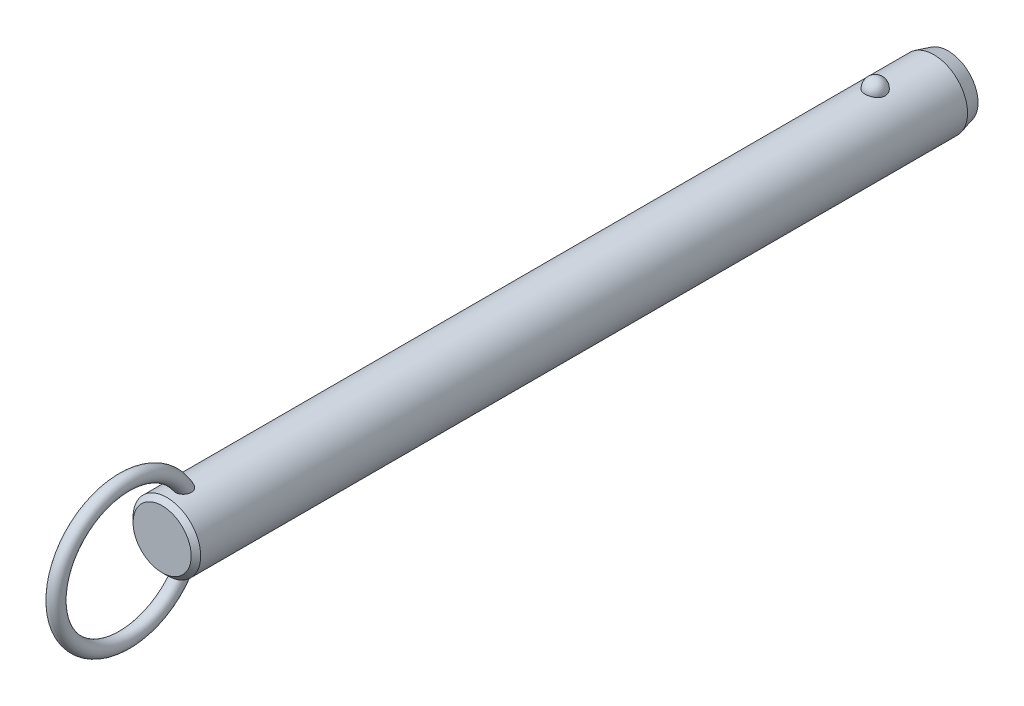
SolidWorks part; units mm, degrees
ref_plane "Front Plane" through (0, 0, 0) normal (0, 0, 1) x (1, 0, 0)
ref_plane "Top Plane" through (0, 0, 0) normal (0, 1, 0) x (1, 0, 0)
ref_plane "Right Plane" through (0, 0, 0) normal (1, 0, 0) x (0, 0, -1)
sketch "Sketch2" plane through (0, 0, 0) normal (0, 0, 1) x (1, 0, 0)
  circle A0 centre (0, 0) radius 7.1
  point P3 (0, 7.1)
  dimension "D1" = 14.2
extrude "Boss-Extrude1" add sketch "Sketch2" along normal blind 139.7
sketch "Sketch3" plane through (0, 0, 0) normal (0, 0, -1) x (-1, 0, 0)
  circle A0 centre (0, 0) radius 7.1
  dimension "D1" = 14.2
extrude "Boss-Extrude2" add sketch "Sketch3" along normal blind 17.4
chamfer "Chamfer1" distance 3 angle 15 1 edges at (-7.1, 0, -17.4)
sketch "Sketch12" plane through (0, 0, 0) normal (1, 0, 0) x (0, 0, -1)
  line L0 (-139.7, 7.1) -> (-139.7, -7.1) construction
  point P0 (-139.7, 0)
sketch "Sketch13" plane through (0, 0, 0) normal (1, 0, 0) x (0, 0, -1)
  circle A0 centre (-155.55, 0) radius 15.85
  point P2 (-139.7, 0)
  dimension "D1" = 31.7
sketch "Sketch14" plane through (0, 0, 0) normal (0, 1, 0) x (1, 0, 0)
  circle A0 centre (0, -141.2) radius 1.5
  point P2 (0, -139.7)
  dimension "D1" = 3
sweep "Sweep1" add profiles "Sketch14" path "Sketch13"
sketch "Sketch15" plane through (0, 0, 139.7) normal (0, 0, 1) x (1, 0, 0)
  circle A0 centre (0, 0) radius 7.1
  dimension "D1" = 14.2
extrude "Boss-Extrude3" add sketch "Sketch15" along normal blind 7.92
chamfer "Chamfer2" distance 1 angle 45 1 edges at (7.1, 0, 147.62)
sketch "Sketch18" plane through (0, 0, 0) normal (1, 0, 0) x (0, 0, -1)
  line L0 (14.4, 7.1) -> (-141.3792, 7.1) construction
  line L1 (2.1, 9.2) -> (2.1, 5)
  line L2 (-141.3792, -7.1) -> (14.4, -7.1) construction
  arc A0 (2.1, 9.2) -> (2.1, 5) centre (2.1, 7.1) ccw
  point P4 (0, 7.1)
  dimension "D1" = 16.3
revolve "Revolve1" add sketch "Sketch18" angle 360 about L1
